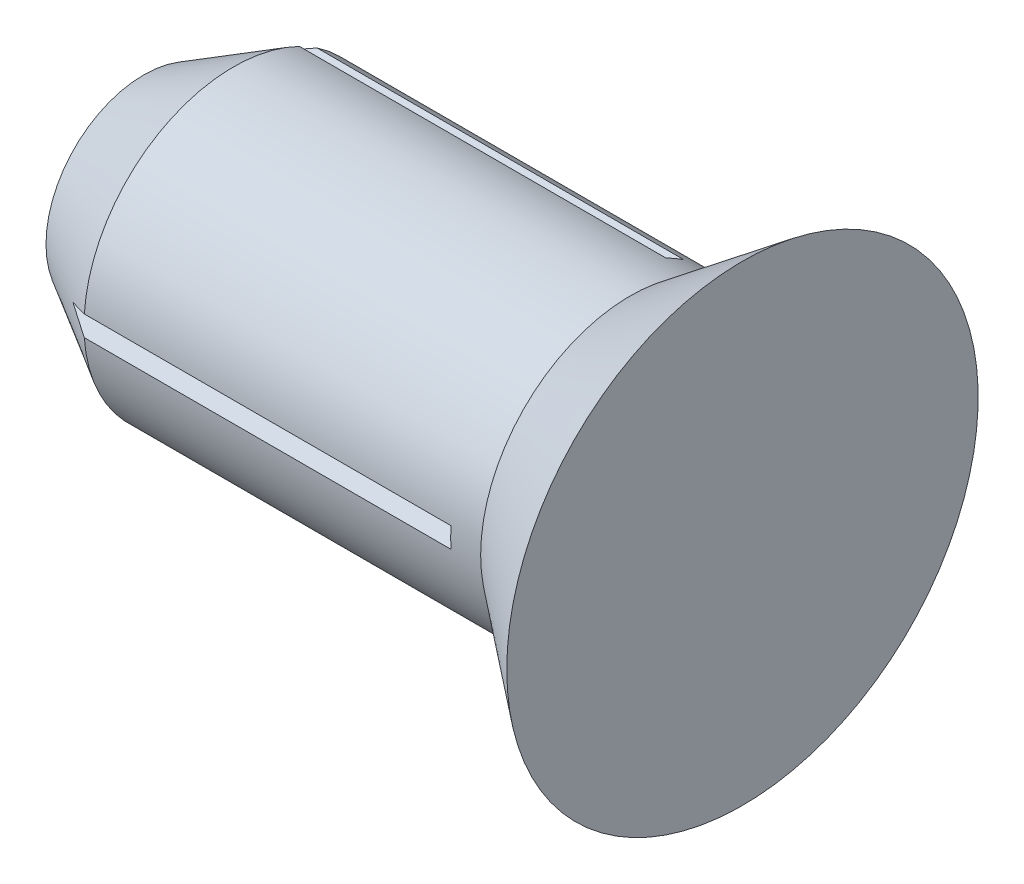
SolidWorks part; units mm, degrees
ref_plane "Plane1" through (0, 0, 0) normal (0, 0, 1) x (1, 0, 0)
ref_plane "Plane2" through (0, 0, 0) normal (0, 1, 0) x (1, 0, 0)
ref_plane "Plane3" through (0, 0, 0) normal (1, 0, 0) x (0, 0, -1)
sketch "Sketch1" plane through (0, 0, 0) normal (0, 0, 1) x (1, 0, 0)
  line L0 (-40, 0) -> (40, 0) construction
  line L1 (-32.5065, 0) -> (-32.5065, 6.5359)
  line L2 (-26.5065, 10) -> (0, 10)
  line L3 (0, 10) -> (7.4935, 15.75)
  line L4 (7.4935, 15.75) -> (7.4935, 0)
  line L5 (0, -10) -> (7.4935, -15.75) construction
  line L6 (7.4935, 0) -> (-32.5065, 0)
  line L7 (-32.5065, 6.5359) -> (-26.5065, 10)
  dimension "D1" = 30
  dimension "HeadDia" = 31.5
  dimension "D2" = 75
  dimension "Diameter" = 20
  dimension "Length" = 40
  dimension "ChamferLength" = 6
revolve "Base-Revolve" add sketch "Sketch1" angle 360 about L0
sketch "Sketch2" plane through (-32.5065, 0, 0) normal (-1, 0, 0) x (0, 0, 1)
  line L0 (0, 0) -> (12, 0) construction
  line L1 (9, 0) -> (10, 0.7002)
  line L2 (9, 0) -> (10, -0.7002)
  line L3 (10, -0.7002) -> (10, 0.7002)
  circle A0 centre (0, 0) radius 9 construction
  circle A1 centre (0, 0) radius 10 construction
  dimension "D1" = 18
  dimension "D2" = 70
  dimension "D3" = 35
extrude "Cut-Extrude1" cut sketch "Sketch2" against normal blind 30.5065
pattern_circular "CirPattern1" count 3 over 360 about axis through (0, 0, 0) along (1, 0, 0) of "Cut-Extrude1"
equation "\"D1@Sketch2\" = \"Diameter@Sketch1\" * .9"
equation "\"D3@Sketch2\" = \"D2@Sketch2\" / 2"
equation "\"D1@Cut-Extrude1\" = \"Length@Sketch1\" - (((\"HeadDia@Sketch1\" - \"Diameter@Sketch1\") / 2.0) / tan((37.5 / 180) * 3.14159265)) - \"ChamferLength@Sketch1\" / 3"
